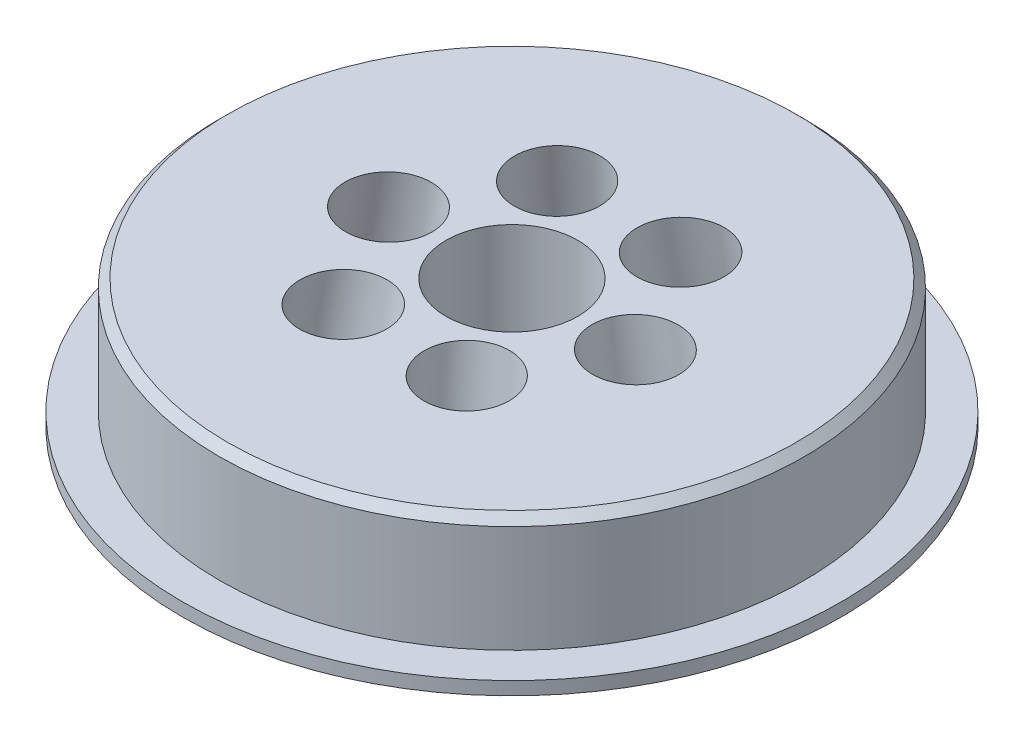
SolidWorks part; units mm, degrees
ref_plane "Face" through (0, 0, 0) normal (0, 0, 1) x (1, 0, 0)
ref_plane "Dessus" through (0, 0, 0) normal (0, 1, 0) x (1, 0, 0)
ref_plane "Droite" through (0, 0, 0) normal (1, 0, 0) x (0, 0, -1)
sketch "Esquisse1" plane through (0, 0, 0) normal (0, 0, 1) x (1, 0, 0)
  line L0 (0, -18) -> (0, 0)
  line L1 (0, 0) -> (-17.75, 0)
  line L2 (-17.75, 0) -> (-17.75, -7)
  line L3 (-17.75, -7) -> (-20, -7)
  line L4 (-20, -7) -> (-20, -7.8)
  line L5 (-4.75, -14) -> (-5.5, -14)
  line L6 (-5.5, -14) -> (-5.5, -8.915)
  line L7 (-5.5, -8.915) -> (-12.5, -7.8)
  line L8 (-12.5, -7.8) -> (-20, -7.8)
  line L9 (-4.75, -14) -> (-4.75, -18)
  line L10 (-4.75, -18) -> (0, -18)
  line L11 (0, 16.478) -> (0, -26.1527) construction
  dimension "D1" = 9.05
  dimension "D2" = 4
  dimension "D3" = 7
  dimension "D4" = 20
  dimension "D5" = 18
  dimension "D6" = 17.75
  dimension "D7" = 7.8
  dimension "D8" = 12.5
  dimension "D9" = 5.5
  dimension "D10" = 4.75
revolve "Base-Révolution" add sketch "Esquisse1" angle 360 about L11
sketch "Esquisse2" plane through (0, 0, 0) normal (0, 1, 0) x (-1, 0, 0)
  circle A0 centre (0, 0) radius 4
  circle A1 centre (0, 0) radius 20 construction
  dimension "D1" = 8
extrude "Enlèv. mat.-Extru.1" cut sketch "Esquisse2" against normal through all
ref_plane "Plan1" through (-9, -8.3575, 0) normal (-0.1573, -0.9876, 0) x (0, 0, -1)
sketch "Esquisse3" plane through (-9, -8.3575, 0) normal (-0.1573, -0.9876, 0) x (0, 0, -1)
  line L0 (0, -1.8473) -> (0, 11.2036) construction
  line L1 (0, 4.9814) -> (0, 11.6871) construction
  circle A0 centre (0, 0.1741) radius 2.6
  ellipse E0 centre (0, 8.9757) end of major axis (-5.5, 8.9757) minor radius 5.4315 construction
  point P2 (0, 0)
  point P18 (0, 3.5441)
  dimension "D1" = 5.2
  dimension "D2" = 3.37
extrude "Enlèv. mat.-Extru.2" cut sketch "Esquisse3" against normal through all
pattern_circular "Répétition circulaire2" count 6 over 360 about axis through (0, 16.478, 0) along (0, -1, 0)
chamfer "Chanfrein1" distance 0.5 angle 45
